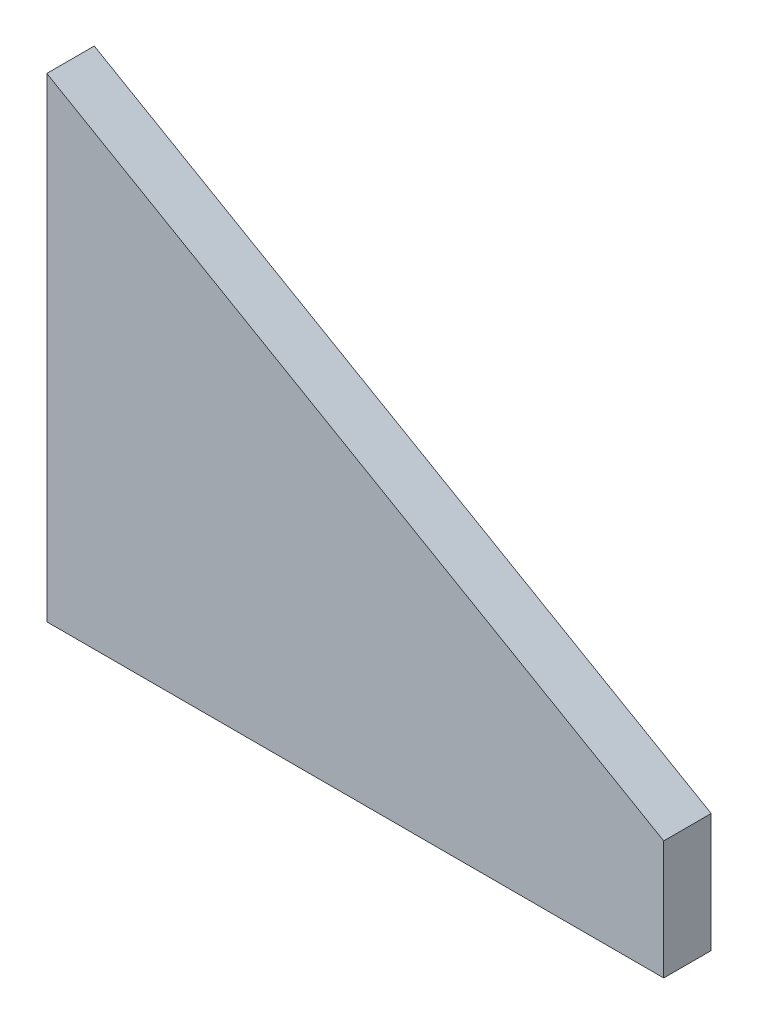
SolidWorks part; units mm, degrees
ref_plane "Ebene vorne" through (0, 0, 0) normal (0, 0, 1) x (1, 0, 0)
ref_plane "Ebene oben" through (0, 0, 0) normal (0, 1, 0) x (1, 0, 0)
ref_plane "Ebene rechts" through (0, 0, 0) normal (1, 0, 0) x (0, 0, -1)
sketch "Skizze1" plane through (0, 0, 0) normal (0, 0, 1) x (1, 0, 0)
  line L0 (0, 0) -> (-259.8076, 0)
  line L1 (-259.8076, 0) -> (-259.8076, 200)
  line L2 (-259.8076, 200) -> (0, 50)
  line L3 (0, 50) -> (0, 0)
  dimension "D1" = 60
  dimension "D2" = 300
  dimension "D3" = 50
extrude "Aufsatz-Linear austragen1" add sketch "Skizze1" along normal blind 20
